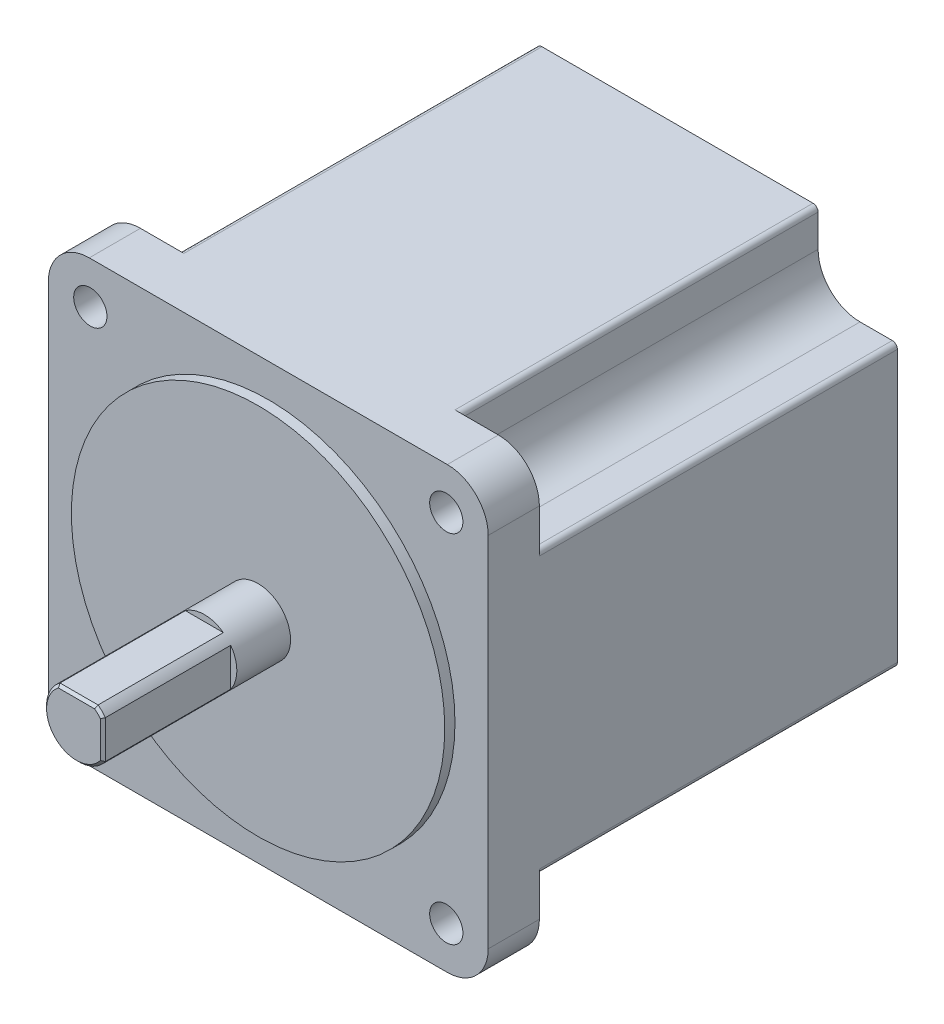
SolidWorks part; units mm, degrees
ref_plane "前视基准面" through (0, 0, 0) normal (0, 0, 1) x (1, 0, 0)
ref_plane "上视基准面" through (0, 0, 0) normal (0, 1, 0) x (1, 0, 0)
ref_plane "右视基准面" through (0, 0, 0) normal (1, 0, 0) x (0, 0, -1)
sketch "草图1" plane through (0, 0, 0) normal (0, 0, 1) x (1, 0, 0)
  circle A0 centre (0, 0) radius 36.5
extrude "凸台-拉伸1" add sketch "草图1" against normal blind 2
sketch "草图2" plane through (0, 0, 0) normal (0, 0, 1) x (1, 0, 0)
  circle A0 centre (0, 0) radius 6.35
extrude "凸台-拉伸2" add sketch "草图2" along normal blind 35.5
sketch "草图3" plane through (0, 0, 35.5) normal (0, 0, 1) x (1, 0, 0)
  line L1 (0, 5.15) -> (4.7381, 5.15)
  line L2 (4.7381, 5.15) -> (4.7381, 8.7654)
  line L3 (4.7381, 8.7654) -> (-5.4014, 8.7654)
  line L4 (-5.4014, 8.7654) -> (-5.4014, 5.15)
  line L5 (-5.4014, 5.15) -> (0, 5.15)
  line L7 (5.15, 0) -> (5.15, -5.0697)
  line L8 (5.15, -5.0697) -> (9.1919, -5.0697)
  line L9 (9.1919, -5.0697) -> (9.1919, 4.4064)
  line L10 (9.1919, 4.4064) -> (5.15, 4.4064)
  line L11 (5.15, 4.4064) -> (5.15, 0)
extrude "切除-拉伸1" cut sketch "草图3" against normal blind 25
sketch "草图4" plane through (0, 0, -2) normal (0, 0, -1) x (-1, 0, 0)
  line L1 (0, 43) -> (35, 43)
  line L2 (43, 35) -> (43, -35)
  line L3 (35, -43) -> (-35, -43)
  line L4 (-43, -35) -> (-43, 35)
  line L5 (-35, 43) -> (0, 43)
  arc A0 (-35, -43) -> (-43, -35) centre (-35, -35) cw
  arc A1 (43, -35) -> (35, -43) centre (35, -35) cw
  arc A2 (35, 43) -> (43, 35) centre (35, 35) cw
  arc A3 (-43, 35) -> (-35, 43) centre (-35, 35) cw
  circle A4 centre (-34.8, 34.8) radius 3.25
  circle A5 centre (34.8, 34.8) radius 3.25
  circle A6 centre (34.8, -34.8) radius 3.25
  circle A7 centre (-34.8, -34.8) radius 3.25
  dimension "D1" = 8
extrude "凸台-拉伸3" add sketch "草图4" along normal blind 80
sketch "草图5" plane through (0, 0, -82) normal (0, 0, -1) x (-1, 0, 0)
  line L1 (35, 43) -> (-35, 43) construction
  line L2 (13.75, 43) -> (26.5, 43)
  line L3 (27.5, 42) -> (27.5, 35.7)
  line L4 (35.7, 27.5) -> (42, 27.5)
  line L5 (43, -35) -> (43, 35) construction
  line L6 (43, 26.5) -> (43, 18.141)
  line L7 (43, 18.141) -> (50.5715, 18.141)
  line L8 (50.5715, 18.141) -> (50.5715, 56.8276)
  line L9 (50.5715, 56.8276) -> (13.75, 56.8276)
  line L10 (13.75, 56.8276) -> (13.75, 43)
  line L12 (-13.75, 56.8276) -> (-13.75, 43)
  line L13 (-50.5715, 56.8276) -> (-13.75, 56.8276)
  line L14 (-50.5715, 18.141) -> (-50.5715, 56.8276)
  line L15 (-43, 18.141) -> (-50.5715, 18.141)
  line L16 (-43, 26.5) -> (-43, 18.141)
  line L17 (-35.7, 27.5) -> (-42, 27.5)
  line L18 (-27.5, 42) -> (-27.5, 35.7)
  line L19 (-13.75, 43) -> (-26.5, 43)
  line L20 (13.75, -56.8276) -> (13.75, -43)
  line L21 (50.5715, -56.8276) -> (13.75, -56.8276)
  line L22 (50.5715, -18.141) -> (50.5715, -56.8276)
  line L23 (43, -18.141) -> (50.5715, -18.141)
  line L24 (43, -26.5) -> (43, -18.141)
  line L25 (35.7, -27.5) -> (42, -27.5)
  line L26 (27.5, -42) -> (27.5, -35.7)
  line L27 (13.75, -43) -> (26.5, -43)
  line L28 (-13.75, -43) -> (-26.5, -43)
  line L29 (-27.5, -42) -> (-27.5, -35.7)
  line L30 (-35.7, -27.5) -> (-42, -27.5)
  line L31 (-43, -26.5) -> (-43, -18.141)
  line L32 (-43, -18.141) -> (-50.5715, -18.141)
  line L33 (-50.5715, -18.141) -> (-50.5715, -56.8276)
  line L34 (-50.5715, -56.8276) -> (-13.75, -56.8276)
  line L35 (-13.75, -56.8276) -> (-13.75, -43)
  arc A0 (27.5, 35.7) -> (35.7, 27.5) centre (35.7, 35.7) ccw
  arc A1 (42, 27.5) -> (43, 26.5) centre (42, 26.5) cw
  arc A2 (26.5, 43) -> (27.5, 42) centre (26.5, 42) cw
  arc A3 (-26.5, 43) -> (-27.5, 42) centre (-26.5, 42) ccw
  arc A4 (-42, 27.5) -> (-43, 26.5) centre (-42, 26.5) ccw
  arc A5 (-27.5, 35.7) -> (-35.7, 27.5) centre (-35.7, 35.7) cw
  arc A6 (26.5, -43) -> (27.5, -42) centre (26.5, -42) ccw
  arc A7 (42, -27.5) -> (43, -26.5) centre (42, -26.5) ccw
  arc A8 (27.5, -35.7) -> (35.7, -27.5) centre (35.7, -35.7) cw
  arc A9 (-27.5, -35.7) -> (-35.7, -27.5) centre (-35.7, -35.7) ccw
  arc A10 (-42, -27.5) -> (-43, -26.5) centre (-42, -26.5) cw
  arc A11 (-26.5, -43) -> (-27.5, -42) centre (-26.5, -42) cw
  point P19 (43, 27.5)
  point P22 (27.5, 43)
  point P38 (-27.5, 43)
  point P39 (-43, 27.5)
  point P54 (27.5, -43)
  point P55 (43, -27.5)
  point P70 (-43, -27.5)
  point P71 (-27.5, -43)
  dimension "D1" = 8.2
  dimension "D2" = 1
extrude "切除-拉伸2" cut sketch "草图5" against normal blind 70
chamfer "倒角1" distance 0.5 angle 45 4 edges at (4.4901, 4.4901, 35.5) (-4.4901, -4.4901, 35.5) (0, 5.15, 35.5) (5.15, 0, 35.5)
